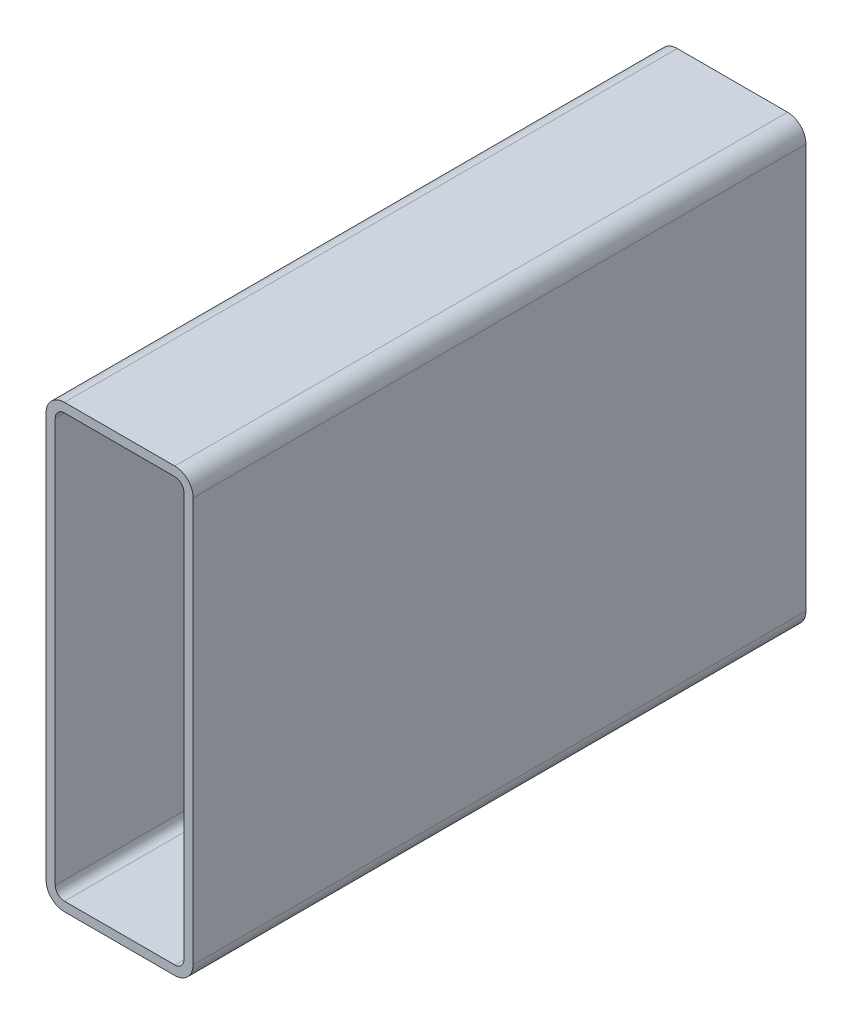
SolidWorks part; units mm, degrees
ref_plane "Front Plane" through (0, 0, 0) normal (0, 0, 1) x (1, 0, 0)
ref_plane "Top Plane" through (0, 0, 0) normal (0, 1, 0) x (1, 0, 0)
ref_plane "Right Plane" through (0, 0, 0) normal (1, 0, 0) x (0, 0, -1)
sketch "Sketch1" plane through (0, 0, 0) normal (0, 0, 1) x (1, 0, 0)
sketch_block_instance "HSS9x3x0.1875-1"
sketch_block "HSS9x3x0.1875"
extrude "Boss-Extrude1" add sketch "Sketch1" along normal blind 317.5
